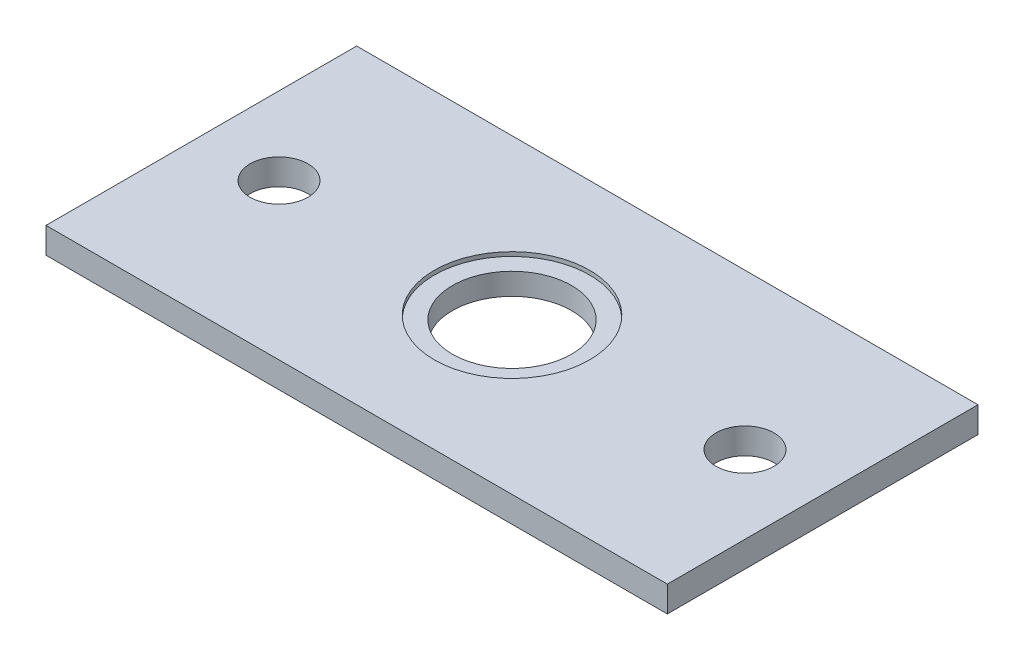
SolidWorks part; units mm, degrees
ref_plane "Front" through (0, 0, 0) normal (0, 0, 1) x (1, 0, 0)
ref_plane "Top" through (0, 0, 0) normal (0, 1, 0) x (1, 0, 0)
ref_plane "Side" through (0, 0, 0) normal (1, 0, 0) x (0, 0, -1)
sketch "Sketch1" plane through (0, 0, 0) normal (0, 1, 0) x (1, 0, 0)
  line L1 (0, 0) -> (76.2, 0)
  line L2 (0, 0) -> (0, 38.1)
  line L3 (0, 38.1) -> (76.2, 38.1)
  line L4 (76.2, 0) -> (76.2, 38.1)
  dimension "D1" = 76.2
  dimension "D2" = 38.1
extrude "Extrude1" add sketch "Sketch1" along normal blind 3.175
sketch "Sketch2" plane through (0, 3.175, 0) normal (0, 1, 0) x (-1, 0, 0)
  line L0 (0, -19.05) -> (-76.2, -19.05) construction
  line L1 (0, -38.1) -> (0, 0) construction
  line L2 (-76.2, 0) -> (-76.2, -38.1) construction
  line L3 (-38.1, -19.05) -> (-38.1, -51.2714) construction
  circle A0 centre (-38.1, -19.05) radius 7.3025
  circle A1 centre (-66.675, -19.05) radius 3.556
  circle A2 centre (-9.525, -19.05) radius 3.556
  dimension "D1" = 7.112
  dimension "D2" = 14.605
  dimension "D3" = 57.15
extrude "Cut-Extrude1" cut sketch "Sketch2" against normal through all
sketch "Sketch3" plane through (0, 3.175, 0) normal (0, 1, 0) x (1, 0, 0)
  circle A0 centre (38.1, 19.05) radius 9.525
  dimension "D1" = 19.05
extrude "Cut-Extrude2" cut sketch "Sketch3" against normal blind 0.508
